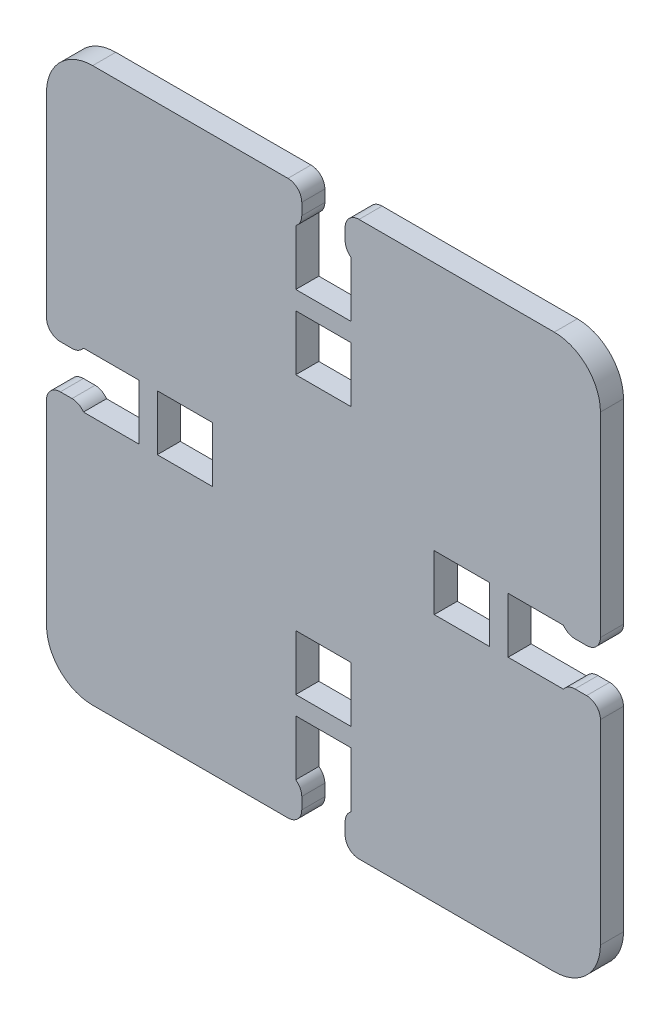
SolidWorks part; units mm, degrees
ref_plane "Front Plane" through (0, 0, 0) normal (0, 0, 1) x (1, 0, 0)
ref_plane "Top Plane" through (0, 0, 0) normal (0, 1, 0) x (1, 0, 0)
ref_plane "Right Plane" through (0, 0, 0) normal (1, 0, 0) x (0, 0, -1)
sketch "Sketch1" plane through (0, 0, 0) normal (0, 0, 1) x (1, 0, 0)
  line L0 (0, -1000) -> (0, 49000) construction
  line L1 (-30, 30) -> (-2.35, 30)
  line L2 (-30, 30) -> (-30, 2.35)
  line L3 (-30, -30) -> (-2.35, -30)
  line L4 (30, 30) -> (30, 2.35)
  line L5 (-30, 30) -> (30, -30) construction
  line L6 (-30, -30) -> (30, 30) construction
  line L7 (2.35, 26) -> (3, 26)
  line L8 (-3, 18) -> (3, 18)
  line L9 (-3, 18) -> (-3, 12)
  line L10 (-3, 12) -> (3, 12)
  line L11 (3, 18) -> (3, 12)
  line L12 (-3, 26) -> (-2.35, 26)
  line L13 (-3, 26) -> (-3, 20)
  line L14 (-3, 20) -> (3, 20)
  line L15 (3, 26) -> (3, 20)
  line L16 (18, 3) -> (12, 3)
  line L17 (-2.35, 30) -> (-2.35, 26)
  line L18 (2.35, 30) -> (30, 30)
  line L19 (2.35, 30) -> (2.35, 26)
  line L20 (12, 3) -> (12, -3)
  line L21 (18, -3) -> (12, -3)
  line L22 (18, 3) -> (18, -3)
  line L23 (26, 3) -> (20, 3)
  line L24 (20, 3) -> (20, -3)
  line L25 (26, -3) -> (20, -3)
  line L26 (26, -2.35) -> (26, -3)
  line L27 (26, 3) -> (26, 2.35)
  line L28 (30, 2.35) -> (26, 2.35)
  line L29 (30, -2.35) -> (26, -2.35)
  line L30 (3, -18) -> (3, -12)
  line L31 (3, -12) -> (-3, -12)
  line L32 (-3, -18) -> (-3, -12)
  line L33 (3, -18) -> (-3, -18)
  line L34 (3, -26) -> (3, -20)
  line L35 (3, -20) -> (-3, -20)
  line L36 (-3, -26) -> (-3, -20)
  line L37 (-2.35, -26) -> (-3, -26)
  line L38 (3, -26) -> (2.35, -26)
  line L39 (2.35, -30) -> (2.35, -26)
  line L40 (-2.35, -30) -> (-2.35, -26)
  line L41 (-18, -3) -> (-12, -3)
  line L42 (-12, -3) -> (-12, 3)
  line L43 (-18, 3) -> (-12, 3)
  line L44 (-18, -3) -> (-18, 3)
  line L45 (-26, -3) -> (-20, -3)
  line L46 (-20, -3) -> (-20, 3)
  line L47 (-26, 3) -> (-20, 3)
  line L48 (-26, 2.35) -> (-26, 3)
  line L49 (-26, -3) -> (-26, -2.35)
  line L50 (-30, -2.35) -> (-26, -2.35)
  line L51 (-30, 2.35) -> (-26, 2.35)
  line L52 (-30, -2.35) -> (-30, -30)
  line L53 (2.35, -30) -> (30, -30)
  line L54 (30, -2.35) -> (30, -30)
  point P0 (0, 0)
  point P59 (0, 0)
  dimension "D1" = 60
  dimension "D2" = 6
  dimension "D3" = 2
  dimension "D4" = 4
  dimension "D5" = 4.7
  dimension "D6" = 4
extrude "Boss-Extrude1" add sketch "Sketch1" along normal blind 2.5
fillet "Fillet1" radius 1.5 16 edges at (2.35, 30, 1.25) (-2.35, 30, 1.25) (2.35, 26, 1.25) (-2.35, 26, 1.25) (-26, 2.35, 1.25) (-26, -2.35, 1.25) (-30, -2.35, 1.25) (-30, 2.35, 1.25) (2.35, -26, 1.25) (-2.35, -26, 1.25) (-2.35, -30, 1.25) (2.35, -30, 1.25) (26, -2.35, 1.25) (30, -2.35, 1.25) (30, 2.35, 1.25) (26, 2.35, 1.25)
fillet "Fillet2" radius 5 4 edges at (-30, 30, 1.25) (-30, -30, 1.25) (30, -30, 1.25) (30, 30, 1.25)
